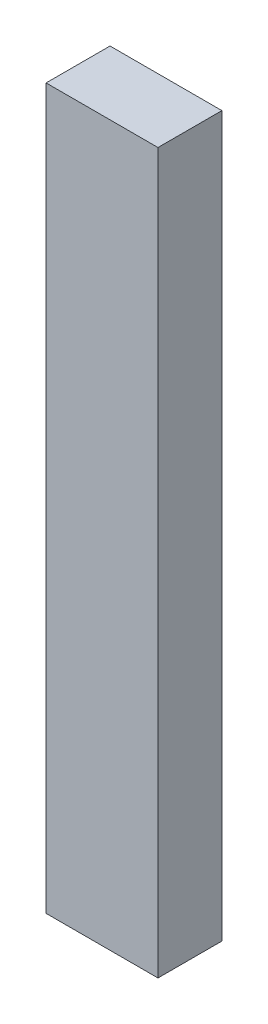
SolidWorks part; units mm, degrees
ref_plane "Plan de face" through (0, 0, 0) normal (0, 0, 1) x (1, 0, 0)
ref_plane "Plan de dessus" through (0, 0, 0) normal (0, 1, 0) x (1, 0, 0)
ref_plane "Plan de droite" through (0, 0, 0) normal (1, 0, 0) x (0, 0, -1)
sketch "Esquisse1" plane through (0, 0, 0) normal (0, 0, 1) x (1, 0, 0)
  line L1 (0, 0) -> (14, 0)
  line L2 (0, 0) -> (0, 90)
  line L3 (0, 90) -> (14, 90)
  line L4 (14, 0) -> (14, 90)
  dimension "D1" = 14
  dimension "D2" = 90
extrude "Extrusion1" add sketch "Esquisse1" along normal blind 8
